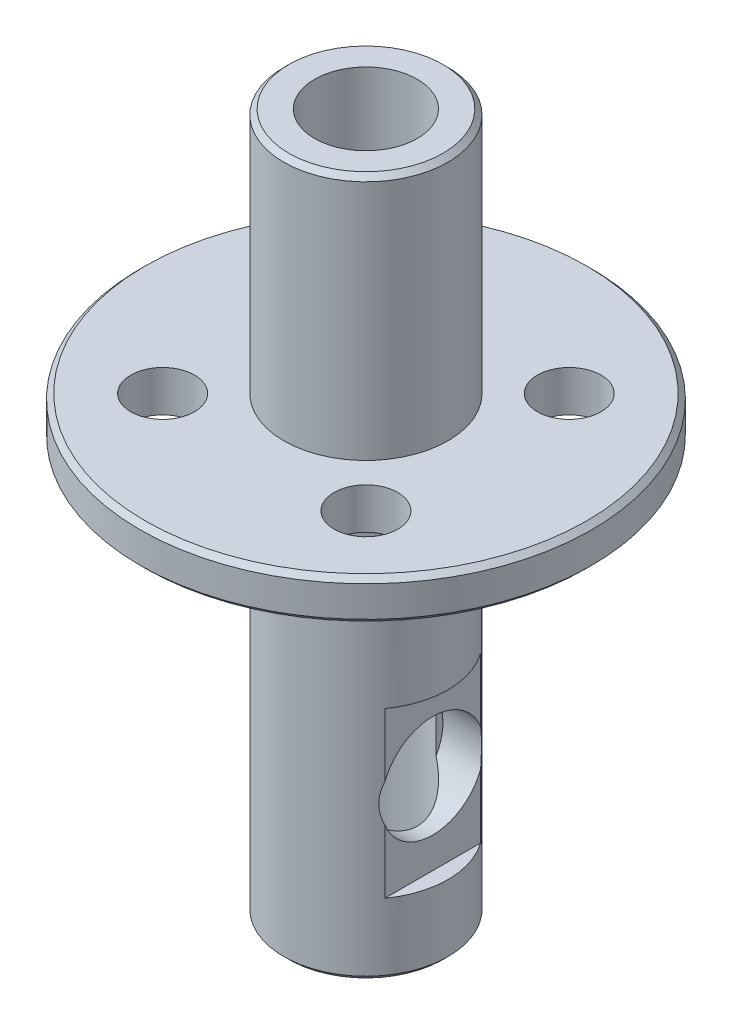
SolidWorks part; units mm, degrees
ref_plane "Front Plane" through (0, 0, 0) normal (0, 0, 1) x (1, 0, 0)
ref_plane "Top Plane" through (0, 0, 0) normal (0, 1, 0) x (1, 0, 0)
ref_plane "Right Plane" through (0, 0, 0) normal (1, 0, 0) x (0, 0, -1)
sketch "Sketch2" plane through (0, 0, 0) normal (0, 1, 0) x (1, 0, 0)
  circle A0 centre (0, 0) radius 11
  dimension "D1" = 22
extrude "Boss-Extrude1" add sketch "Sketch2" along normal blind 2
sketch "Sketch3" plane through (0, 2, 0) normal (0, 1, 0) x (1, 0, 0)
  circle A0 centre (0, 0) radius 4
  dimension "D1" = 8
extrude "Boss-Extrude2" add sketch "Sketch3" along normal blind 12
sketch "Sketch4" plane through (0, 0, 0) normal (0, -1, 0) x (1, 0, 0)
  circle A0 centre (0, 0) radius 4
  dimension "D1" = 8
extrude "Boss-Extrude3" add sketch "Sketch4" along normal blind 20
sketch "Sketch5" plane through (0, 14, 0) normal (0, 1, 0) x (1, 0, 0)
  circle A0 centre (0, 0) radius 2.5
  dimension "D1" = 5
extrude "Cut-Extrude1" cut sketch "Sketch5" against normal through all
ref_plane "Plane2" through (4, 0, 0) normal (1, 0, 0) x (0, 0, -1)
sketch "Sketch7" plane through (4, 0, 0) normal (1, 0, 0) x (0, 0, -1)
  line L1 (2.5, -16.5) -> (-2.5, -16.5)
  line L2 (2.5, -16.5) -> (2.5, -8.5)
  line L3 (2.5, -8.5) -> (-2.5, -8.5)
  line L4 (-2.5, -16.5) -> (-2.5, -8.5)
  line L5 (2.5, -16.5) -> (-2.5, -8.5) construction
  line L6 (2.5, -8.5) -> (-2.5, -16.5) construction
  line L7 (-4, -20) -> (4, -20) construction
  point P0 (0, -12.5)
  point P7 (0, 0)
  dimension "D1" = 8
  dimension "D2" = 5
  dimension "D3" = 7.5
extrude "Cut-Extrude2" cut sketch "Sketch7" against normal blind 0.75
sketch "Sketch8" plane through (3.25, 0, 0) normal (1, 0, 0) x (0, 0, -1)
  line L0 (-4, -20) -> (4, -20) construction
  circle A0 centre (0, -12.5) radius 2.5
  point P2 (0, 0)
  dimension "D1" = 5
  dimension "D2" = 7.5
extrude "Cut-Extrude3" cut sketch "Sketch8" against normal blind 2
sketch "Sketch9" plane through (0, 2, 0) normal (0, 1, 0) x (1, 0, 0)
  line L0 (0, 0) -> (11, 0) construction
  line L1 (0, 0) -> (0, 11) construction
  line L2 (0, 0) -> (7.7782, 7.7782) construction
  circle A0 centre (0, 0) radius 7 construction
  circle A1 centre (4.9497, 4.9497) radius 1.55
  circle A2 centre (0, 0) radius 11 construction
  circle A3 centre (4.9497, -4.9497) radius 1.55
  circle A4 centre (-4.9497, -4.9497) radius 1.55
  circle A5 centre (-4.9497, 4.9497) radius 1.55
  point P20 (0, 0)
  dimension "D1" = 14
  dimension "D2" = 3.1
  dimension "D3" = 45
  dimension "D4" = 4
extrude "Cut-Extrude5" cut sketch "Sketch9" against normal through all
chamfer "Chamfer1" distance 0.25 angle 45 4 edges at (0, -20, -4) (0, 14, 4) (0, 0, 11) (0, 2, 11)
